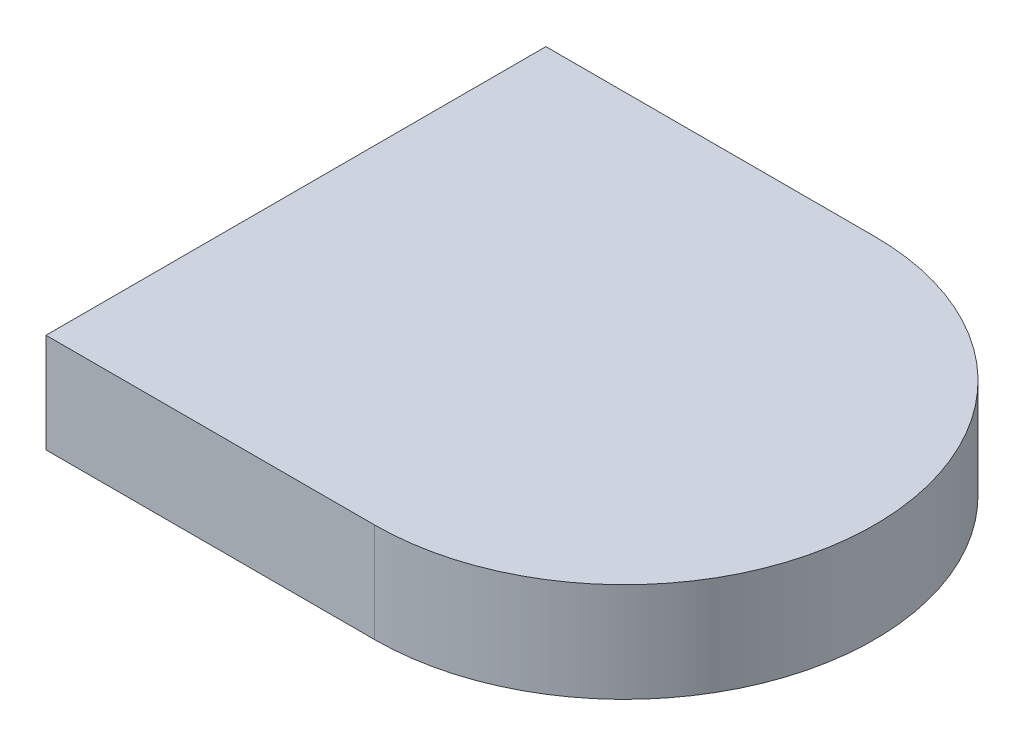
SolidWorks part; units mm, degrees
ref_plane "Front Plane" through (0, 0, 0) normal (0, 0, 1) x (1, 0, 0)
ref_plane "Top Plane" through (0, 0, 0) normal (0, 1, 0) x (1, 0, 0)
ref_plane "Right Plane" through (0, 0, 0) normal (1, 0, 0) x (0, 0, -1)
sketch "Sketch1" plane through (0, 0, 0) normal (0, 1, 0) x (1, 0, 0)
  line L0 (0, 75.5091) -> (-99.2693, 75.5091)
  line L1 (-99.2693, 75.5091) -> (-99.2693, -75.5091)
  line L2 (-99.2693, -75.5091) -> (0, -75.5091)
  arc A0 (0, 75.5091) -> (0, -75.5091) centre (0, 0) cw
extrude "Extrude1" add sketch "Sketch1" along normal blind 30
